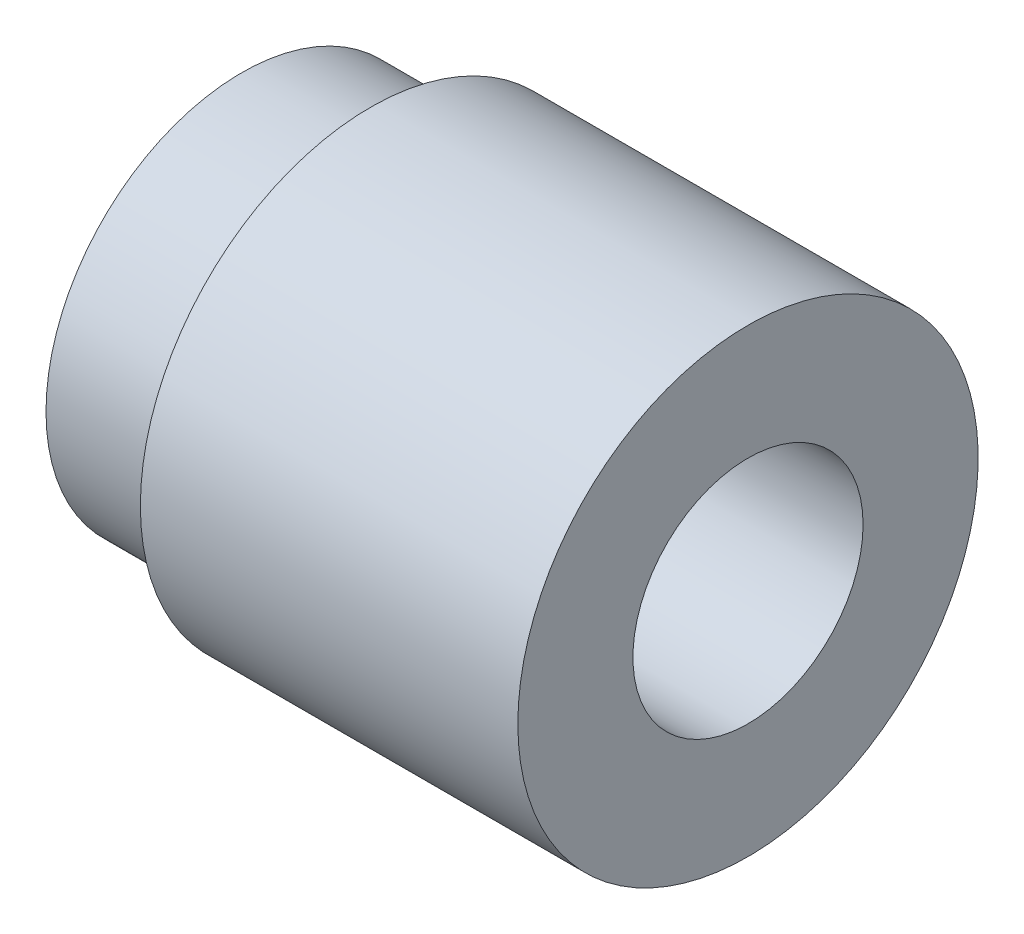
SolidWorks part; units mm, degrees
ref_plane "Płaszczyzna przednia" through (0, 0, 0) normal (0, 0, 1) x (1, 0, 0)
ref_plane "Płaszczyzna górna" through (0, 0, 0) normal (0, 1, 0) x (1, 0, 0)
ref_plane "Płaszczyzna prawa" through (0, 0, 0) normal (1, 0, 0) x (0, 0, -1)
sketch "Szkic1" plane through (0, 0, 0) normal (0, 0, 1) x (1, 0, 0)
  line L0 (-0.159, 0) -> (8864.9196, 0) construction
  line L1 (0, 0) -> (0, 2.125)
  line L2 (0, 2.125) -> (1.4, 2.125)
  line L3 (1.4, 2.125) -> (1.4, 2.5)
  line L4 (1.4, 2.5) -> (5.5, 2.5)
  line L5 (5.5, 2.5) -> (5.5, 0)
  line L6 (5.5, 0) -> (0, 0)
  dimension "D1" = 4.25
  dimension "D2" = 5
  dimension "D3" = 1.4
  dimension "D4" = 5.5
revolve "Obrót1" add sketch "Szkic1" angle 360 about L0
hole_wizard "Otwór gwintowany M31" positions "Szkic2" profile "Szkic3" tap size "M3" standard "DIN"
sketch "Szkic2" plane through (5.5, 0, 0) normal (1, 0, 0) x (0, 0, -1)
  point P0 (0, 0)
sketch "Szkic3" plane through (5.5, 0, 0) normal (0, 1, 0) x (0, 0, -1)
  line L0 (0, 0) -> (0, 5.5)
  line L1 (0, 5.5) -> (1.25, 5.5)
  line L2 (1.25, 5.5) -> (1.25, 0)
  line L5 (1.25, 0) -> (0, 0)
  line L11 (0, -6.35) -> (0, 107.95) construction
  dimension "Średnica otworu gwintowanego na wylot" = 2.5
  dimension "Głębokość otworu gwintowanego na wylot" = 5.5
